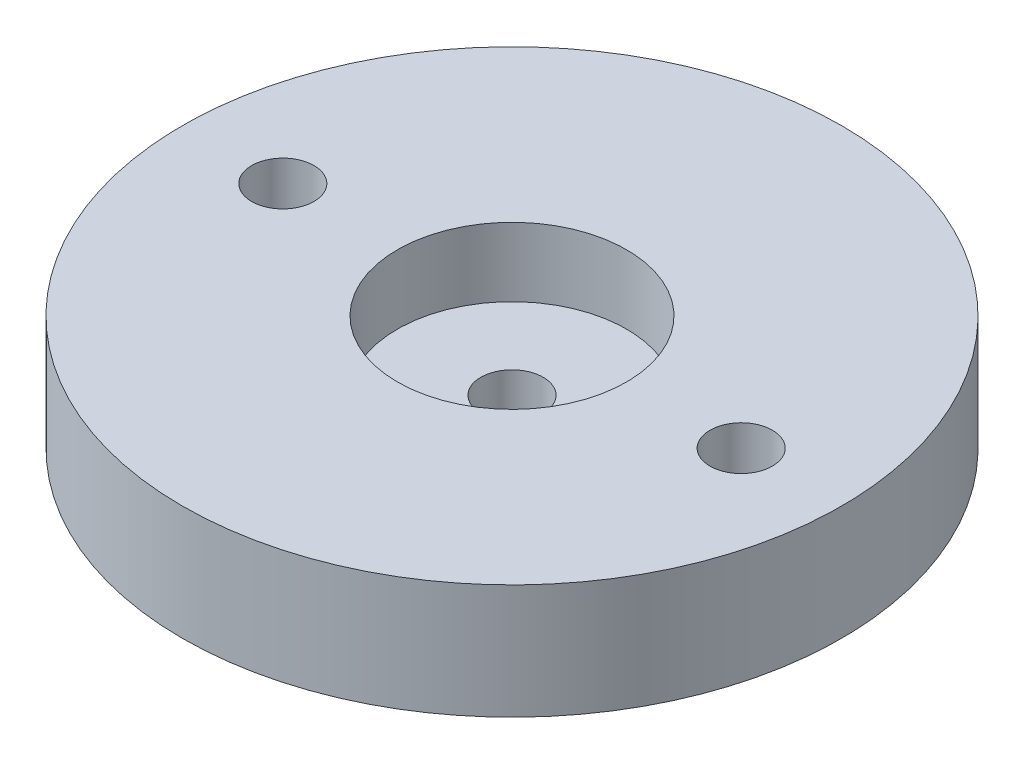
SolidWorks part; units mm, degrees
ref_plane "Front Plane" through (0, 0, 0) normal (0, 0, 1) x (1, 0, 0)
ref_plane "Top Plane" through (0, 0, 0) normal (0, 1, 0) x (1, 0, 0)
ref_plane "Right Plane" through (0, 0, 0) normal (1, 0, 0) x (0, 0, -1)
sketch "Sketch1" plane through (0, 0, 0) normal (0, 1, 0) x (1, 0, 0)
  circle A0 centre (0, 0) radius 18.2626
  circle A1 centre (0, 0) radius 1.7272
  dimension "D1" = 36.5252
  dimension "D2" = 3.4544
extrude "Boss-Extrude1" add sketch "Sketch1" along normal blind 6.35
sketch "Sketch2" plane through (0, 6.35, 0) normal (0, 1, 0) x (1, 0, 0)
  circle A0 centre (0, 0) radius 6.35
  dimension "D1" = 12.7
extrude "Cut-Extrude1" cut sketch "Sketch2" against normal blind 3.81
sketch "Sketch3" plane through (0, 0, 0) normal (0, 1, 0) x (1, 0, 0)
  line L0 (-12.7, 0) -> (12.7, 0) construction
  circle A0 centre (-12.7, 0) radius 1.7272
  circle A1 centre (12.7, 0) radius 1.7272
  point P6 (0, 0)
  dimension "D1" = 3.4544
  dimension "D2" = 25.4
extrude "Cut-Extrude2" cut sketch "Sketch3" along normal through all
